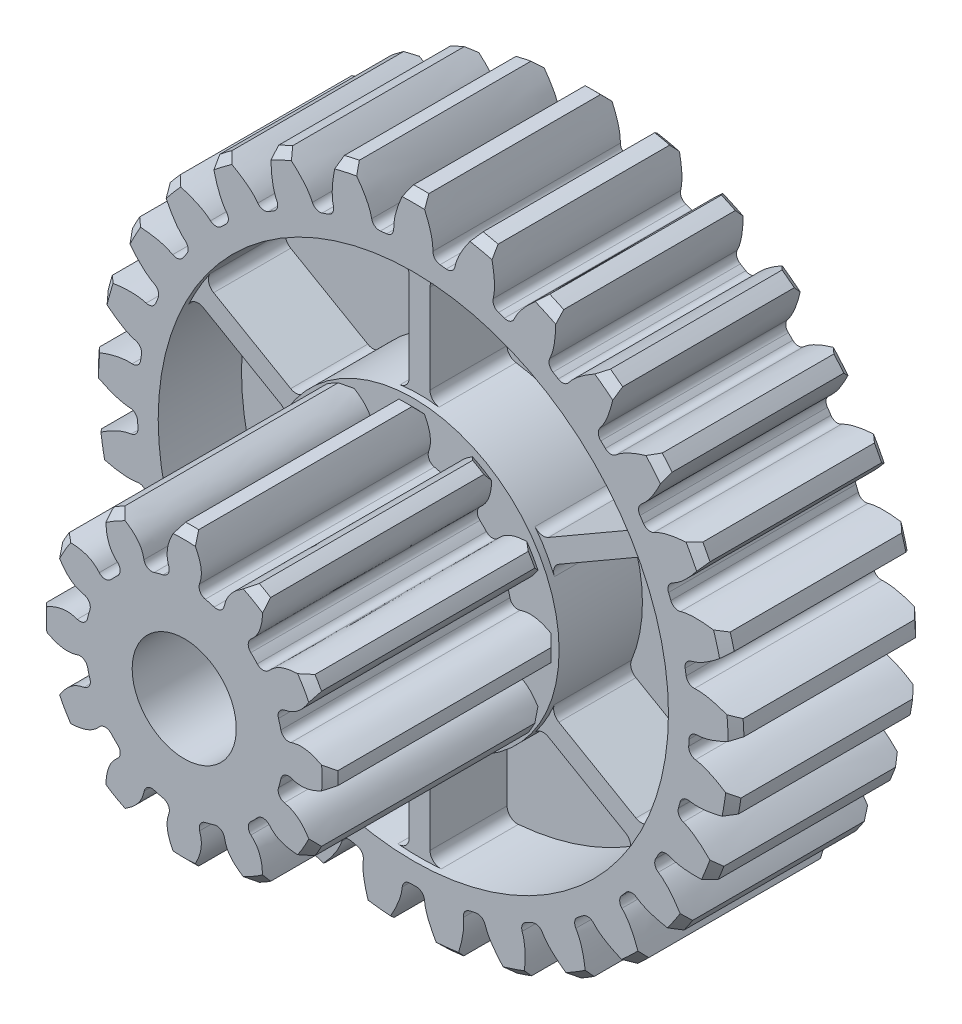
SolidWorks part; units mm, degrees
ref_plane "Plan de face" through (0, 0, 0) normal (0, 0, 1) x (1, 0, 0)
ref_plane "Plan de dessus" through (0, 0, 0) normal (0, 1, 0) x (1, 0, 0)
ref_plane "Plan de droite" through (0, 0, 0) normal (1, 0, 0) x (0, 0, -1)
other "Joindre1"
other "Roue dentée 29 dents module 1<1>@Roues dentées droites"
other "Roue dentée 12 dents module 1<1>@Roues dentées droites"
sketch "Esquisse2" plane through (0, 0, -14.5) normal (0, 0, -1) x (-1, 0, 0)
  circle A0 centre (4.4099, 0.9212) radius 2.5
  dimension "D1" = 5
extrude "Enlèv. mat.-Extru.1" cut sketch "Esquisse2" against normal through all
sketch "Esquisse3" plane through (0, 0, -14.5) normal (0, 0, -1) x (-1, 0, 0)
  line L0 (4.4099, 31.8895) -> (4.4099, -30.0472) construction
  line L1 (-26.6662, 18.863) -> (35.4861, -17.0206) construction
  line L2 (33.2505, 17.5723) -> (-24.4306, -15.7299) construction
  line L3 (3.9099, 12.6286) -> (3.9099, 4.7942)
  line L4 (14.2988, 7.2079) -> (7.514, 3.2907)
  line L5 (-5.9789, 6.3419) -> (0.8058, 2.4247)
  line L6 (4.9099, 12.6286) -> (4.9099, 4.7942)
  line L7 (1.3058, -1.4483) -> (-5.4789, -5.3655)
  line L8 (-5.4789, 7.2079) -> (1.3058, 3.2907)
  line L9 (14.7988, 6.3419) -> (8.014, 2.4247)
  line L10 (-26.4162, 19.296) -> (35.7361, -16.5876) construction
  line L11 (-26.9162, 18.43) -> (35.2361, -17.4536) construction
  line L12 (4.9099, 31.8895) -> (4.9099, -30.0472) construction
  line L13 (3.9099, 31.8895) -> (3.9099, -30.0472) construction
  line L14 (33.0005, 18.0053) -> (-24.6806, -15.2969) construction
  line L15 (0.8058, -0.5823) -> (-5.9789, -4.4995)
  line L16 (7.514, -1.4483) -> (14.2988, -5.3655)
  line L18 (3.9099, -2.9518) -> (3.9099, -10.7862)
  line L19 (8.014, -0.5823) -> (14.7988, -4.4995)
  line L20 (4.9099, -2.9518) -> (4.9099, -10.7862)
  arc A0 (5.4525, -11.2844) -> (14.459, -6.0845) centre (4.4099, 0.9212) ccw
  arc A1 (-5.6391, -6.0845) -> (3.3674, -11.2844) centre (4.4099, 0.9212) ccw
  circle A2 centre (4.4099, 0.9212) radius 3.5
  arc A3 (5.2849, -2.4677) -> (6.9073, -1.531) centre (4.4099, 0.9212) ccw
  circle A4 centre (4.4099, 0.9212) radius 13.25 construction
  arc A5 (-4.5927, 10.643) -> (-4.8102, 10.437) centre (4.4099, 0.9212) ccw construction
  arc A6 (-6.6817, 6.1211) -> (-6.6817, -4.2787) centre (4.4099, 0.9212) ccw
  arc A7 (3.3674, 13.1267) -> (-5.6391, 7.9268) centre (4.4099, 0.9212) ccw
  circle A8 centre (4.4099, 0.9212) radius 12.25 construction
  arc A9 (14.459, 7.9268) -> (5.4525, 13.1267) centre (4.4099, 0.9212) ccw
  arc A10 (15.5015, -4.2787) -> (15.5015, 6.1211) centre (4.4099, 0.9212) ccw
  arc A11 (7.7823, -0.0155) -> (7.7823, 1.8578) centre (4.4099, 0.9212) ccw
  arc A12 (1.9126, -1.531) -> (3.5349, -2.4677) centre (4.4099, 0.9212) ccw
  arc A13 (1.0376, 1.8578) -> (1.0376, -0.0155) centre (4.4099, 0.9212) ccw
  arc A14 (3.5349, 4.31) -> (1.9126, 3.3734) centre (4.4099, 0.9212) ccw
  arc A15 (6.9073, 3.3734) -> (5.2849, 4.31) centre (4.4099, 0.9212) ccw
  arc A16 (4.9099, -10.7862) -> (5.4525, -11.2844) centre (5.4099, -10.7862) ccw
  arc A17 (3.9099, -10.7862) -> (3.3674, -11.2844) centre (3.4099, -10.7862) cw
  arc A18 (-5.4789, -5.3655) -> (-5.6391, -6.0845) centre (-5.2289, -5.7985) ccw
  arc A19 (-5.9789, -4.4995) -> (-6.6817, -4.2787) centre (-6.2289, -4.0665) cw
  arc A20 (0.8058, 2.4247) -> (1.0376, 1.8578) centre (0.5558, 1.9917) cw
  arc A21 (0.8058, -0.5823) -> (1.0376, -0.0155) centre (0.5558, -0.1493) ccw
  arc A22 (1.3058, -1.4483) -> (1.9126, -1.531) centre (1.5558, -1.8813) cw
  arc A23 (3.9099, -2.9518) -> (3.5349, -2.4677) centre (3.4099, -2.9518) ccw
  arc A24 (4.9099, -2.9518) -> (5.2849, -2.4677) centre (5.4099, -2.9518) cw
  arc A25 (7.514, -1.4483) -> (6.9073, -1.531) centre (7.264, -1.8813) ccw
  arc A26 (14.459, -6.0845) -> (14.2988, -5.3655) centre (14.0488, -5.7985) ccw
  arc A27 (15.5015, -4.2787) -> (14.7988, -4.4995) centre (15.0488, -4.0665) cw
  arc A28 (8.014, -0.5823) -> (7.7823, -0.0155) centre (8.264, -0.1493) cw
  arc A29 (8.014, 2.4247) -> (7.7823, 1.8578) centre (8.264, 1.9917) ccw
  arc A30 (14.7988, 6.3419) -> (15.5015, 6.1211) centre (15.0488, 5.9088) cw
  arc A31 (14.2988, 7.2079) -> (14.459, 7.9268) centre (14.0488, 7.6409) ccw
  arc A32 (4.9099, 12.6286) -> (5.4525, 13.1267) centre (5.4099, 12.6286) cw
  arc A33 (7.514, 3.2907) -> (6.9073, 3.3734) centre (7.264, 3.7237) cw
  arc A34 (4.9099, 4.7942) -> (5.2849, 4.31) centre (5.4099, 4.7942) ccw
  arc A35 (1.3058, 3.2907) -> (1.9126, 3.3734) centre (1.5558, 3.7237) ccw
  arc A36 (3.9099, 4.7942) -> (3.5349, 4.31) centre (3.4099, 4.7942) cw
  arc A37 (3.9099, 12.6286) -> (3.3674, 13.1267) centre (3.4099, 12.6286) ccw
  arc A38 (-5.9789, 6.3419) -> (-6.6817, 6.1211) centre (-6.2289, 5.9088) ccw
  arc A39 (-5.4789, 7.2079) -> (-5.6391, 7.9268) centre (-5.2289, 7.6409) cw
  point P15 (33.5005, 17.1393)
  point P16 (-24.1806, -16.1629)
  point P30 (16.6599, 0.9212)
  point P55 (4.9099, -11.3186)
  point P60 (-5.94, -5.6317)
  point P65 (1.1599, 2.2202)
  point P68 (1.1599, -0.3779)
  point P71 (1.6599, -1.2439)
  point P84 (7.6599, -0.3779)
  point P87 (7.6599, 2.2202)
  point P92 (14.7599, 7.4741)
  point P97 (7.1599, 3.0862)
  point P100 (4.9099, 4.3853)
  point P103 (1.6599, 3.0862)
  point P106 (3.9099, 4.3853)
  point P109 (3.9099, 13.161)
  dimension "D7" = 0.5
  dimension "D1" = 60
  dimension "D2" = 60
  dimension "D3" = 0.5
  dimension "D4" = 0.5
  dimension "D5" = 1
  dimension "D6" = 1
extrude "Enlèv. mat.-Extru.2" cut sketch "Esquisse3" against normal blind 4
sketch "Esquisse4" plane through (0, 0, -5.5) normal (0, 0, 1) x (1, 0, 0)
  line L0 (-4.9099, 12.6286) -> (-4.9099, 4.7942) construction
  line L1 (-7.514, 3.2907) -> (-14.2988, 7.2079) construction
  line L2 (-3.9099, 4.7942) -> (-3.9099, 12.6286) construction
  line L3 (5.4789, 7.2079) -> (-1.3058, 3.2907) construction
  line L4 (-14.7988, 6.3419) -> (-8.014, 2.4247) construction
  line L5 (-8.014, -0.5823) -> (-14.7988, -4.4995) construction
  line L6 (-14.2988, -5.3655) -> (-7.514, -1.4483) construction
  line L7 (-4.9099, -2.9518) -> (-4.9099, -10.7862) construction
  line L8 (-3.9099, -10.7862) -> (-3.9099, -2.9518) construction
  line L9 (-1.3058, -1.4483) -> (5.4789, -5.3655) construction
  line L10 (5.9789, -4.4995) -> (-0.8058, -0.5823) construction
  line L11 (-0.8058, 2.4247) -> (5.9789, 6.3419) construction
  line L12 (-4.9099, 12.6286) -> (-4.9099, 8.3542)
  line L13 (-10.5971, 5.0707) -> (-14.2988, 7.2079)
  line L14 (-3.9099, 8.3542) -> (-3.9099, 12.6286)
  line L15 (5.4789, 7.2079) -> (1.7773, 5.0707)
  line L16 (-14.7988, 6.3419) -> (-11.0971, 4.2047)
  line L17 (-11.0971, -2.3623) -> (-14.7988, -4.4995)
  line L18 (-14.2988, -5.3655) -> (-10.5971, -3.2283)
  line L19 (-4.9099, -6.5118) -> (-4.9099, -10.7862)
  line L20 (-3.9099, -10.7862) -> (-3.9099, -6.5118)
  line L21 (1.7773, -3.2283) -> (5.4789, -5.3655)
  line L22 (5.9789, -4.4995) -> (2.2773, -2.3623)
  line L23 (2.2773, 4.2047) -> (5.9789, 6.3419)
  arc A0 (-14.459, 7.9268) -> (-14.2988, 7.2079) centre (-14.0488, 7.6409) ccw construction
  arc A1 (-5.4525, 13.1267) -> (-14.459, 7.9268) centre (-4.4099, 0.9212) ccw construction
  arc A2 (-4.9099, 12.6286) -> (-5.4525, 13.1267) centre (-5.4099, 12.6286) ccw construction
  arc A9 (-3.3674, 13.1267) -> (-3.9099, 12.6286) centre (-3.4099, 12.6286) ccw construction
  arc A10 (5.6391, 7.9268) -> (-3.3674, 13.1267) centre (-4.4099, 0.9212) ccw construction
  arc A11 (5.4789, 7.2079) -> (5.6391, 7.9268) centre (5.2289, 7.6409) ccw construction
  arc A12 (-15.5015, -4.2787) -> (-14.7988, -4.4995) centre (-15.0488, -4.0665) ccw construction
  arc A13 (-15.5015, 6.1211) -> (-15.5015, -4.2787) centre (-4.4099, 0.9212) ccw construction
  arc A14 (-14.7988, 6.3419) -> (-15.5015, 6.1211) centre (-15.0488, 5.9088) ccw construction
  arc A18 (-5.4525, -11.2844) -> (-4.9099, -10.7862) centre (-5.4099, -10.7862) ccw construction
  arc A19 (-14.459, -6.0845) -> (-5.4525, -11.2844) centre (-4.4099, 0.9212) ccw construction
  arc A20 (-14.2988, -5.3655) -> (-14.459, -6.0845) centre (-14.0488, -5.7985) ccw construction
  arc A24 (-3.9099, -10.7862) -> (-3.3674, -11.2844) centre (-3.4099, -10.7862) ccw construction
  arc A28 (5.6391, -6.0845) -> (5.4789, -5.3655) centre (5.2289, -5.7985) ccw construction
  arc A29 (-3.3674, -11.2844) -> (5.6391, -6.0845) centre (-4.4099, 0.9212) ccw construction
  arc A30 (5.9789, -4.4995) -> (6.6817, -4.2787) centre (6.2289, -4.0665) ccw construction
  arc A34 (6.6817, 6.1211) -> (5.9789, 6.3419) centre (6.2289, 5.9088) ccw construction
  arc A35 (6.6817, -4.2787) -> (6.6817, 6.1211) centre (-4.4099, 0.9212) ccw construction
  arc A36 (-14.459, 7.9268) -> (-14.2988, 7.2079) centre (-14.0488, 7.6409) ccw
  arc A37 (-5.4525, 13.1267) -> (-14.459, 7.9268) centre (-4.4099, 0.9212) ccw
  arc A38 (-4.9099, 12.6286) -> (-5.4525, 13.1267) centre (-5.4099, 12.6286) ccw
  arc A39 (-10.8846, 3.5816) -> (-10.8846, -1.7393) centre (-4.4099, 0.9212) ccw
  arc A40 (-9.9513, -3.3559) -> (-5.3433, -6.0163) centre (-4.4099, 0.9212) ccw
  arc A41 (-3.4766, -6.0163) -> (1.1315, -3.3559) centre (-4.4099, 0.9212) ccw
  arc A42 (2.0648, -1.7393) -> (2.0648, 3.5816) centre (-4.4099, 0.9212) ccw
  arc A43 (1.1315, 5.1982) -> (-3.4766, 7.8587) centre (-4.4099, 0.9212) ccw
  arc A44 (-4.9099, 8.3542) -> (-5.3433, 7.8587) centre (-5.4099, 8.3542) cw
  arc A45 (-3.3674, 13.1267) -> (-3.9099, 12.6286) centre (-3.4099, 12.6286) ccw
  arc A46 (5.6391, 7.9268) -> (-3.3674, 13.1267) centre (-4.4099, 0.9212) ccw
  arc A47 (5.4789, 7.2079) -> (5.6391, 7.9268) centre (5.2289, 7.6409) ccw
  arc A48 (-15.5015, -4.2787) -> (-14.7988, -4.4995) centre (-15.0488, -4.0665) ccw
  arc A49 (-15.5015, 6.1211) -> (-15.5015, -4.2787) centre (-4.4099, 0.9212) ccw
  arc A50 (-14.7988, 6.3419) -> (-15.5015, 6.1211) centre (-15.0488, 5.9088) ccw
  arc A51 (-3.9099, 8.3542) -> (-3.4766, 7.8587) centre (-3.4099, 8.3542) ccw
  arc A52 (1.7773, 5.0707) -> (1.1315, 5.1982) centre (1.5273, 5.5037) cw
  arc A53 (2.2773, 4.2047) -> (2.0648, 3.5816) centre (2.5273, 3.7717) ccw
  arc A54 (-5.4525, -11.2844) -> (-4.9099, -10.7862) centre (-5.4099, -10.7862) ccw
  arc A55 (-14.459, -6.0845) -> (-5.4525, -11.2844) centre (-4.4099, 0.9212) ccw
  arc A56 (-14.2988, -5.3655) -> (-14.459, -6.0845) centre (-14.0488, -5.7985) ccw
  arc A57 (2.2773, -2.3623) -> (2.0648, -1.7393) centre (2.5273, -1.9293) cw
  arc A58 (1.7773, -3.2283) -> (1.1315, -3.3559) centre (1.5273, -3.6614) ccw
  arc A59 (-3.9099, -6.5118) -> (-3.4766, -6.0163) centre (-3.4099, -6.5118) cw
  arc A60 (-3.9099, -10.7862) -> (-3.3674, -11.2844) centre (-3.4099, -10.7862) ccw
  arc A61 (-4.9099, -6.5118) -> (-5.3433, -6.0163) centre (-5.4099, -6.5118) ccw
  arc A62 (-10.5971, -3.2283) -> (-9.9513, -3.3559) centre (-10.3471, -3.6614) cw
  arc A63 (-11.0971, -2.3623) -> (-10.8846, -1.7393) centre (-11.3471, -1.9293) ccw
  arc A64 (5.6391, -6.0845) -> (5.4789, -5.3655) centre (5.2289, -5.7985) ccw
  arc A65 (-3.3674, -11.2844) -> (5.6391, -6.0845) centre (-4.4099, 0.9212) ccw
  arc A66 (5.9789, -4.4995) -> (6.6817, -4.2787) centre (6.2289, -4.0665) ccw
  arc A67 (-11.0971, 4.2047) -> (-10.8846, 3.5816) centre (-11.3471, 3.7717) cw
  arc A68 (-10.5971, 5.0707) -> (-9.9513, 5.1982) centre (-10.3471, 5.5037) ccw
  arc A70 (6.6817, 6.1211) -> (5.9789, 6.3419) centre (6.2289, 5.9088) ccw
  arc A71 (6.6817, -4.2787) -> (6.6817, 6.1211) centre (-4.4099, 0.9212) ccw
  arc A72 (-5.3433, 7.8587) -> (-9.9513, 5.1982) centre (-4.4099, 0.9212) ccw
  point P31 (1.3868, 4.8453)
  point P43 (1.8868, 3.9792)
  point P52 (1.8868, -2.1369)
  point P64 (1.3868, -3.0029)
  point P73 (-3.9099, -6.0609)
  point P80 (-4.9099, -6.0609)
  point P84 (-10.2066, -3.0029)
  point P89 (-10.7066, -2.1369)
  point P92 (-10.7066, 3.9792)
  dimension "D1" = 0.5
extrude "Enlèv. mat.-Extru.3" cut sketch "Esquisse4" against normal blind 4
sketch "Esquisse5" plane through (0, 0, -14.5) normal (0, 0, -1) x (-1, 0, 0)
  arc A0 (5.4525, -11.2844) -> (14.459, -6.0845) centre (4.4099, 0.9212) ccw construction
  circle A1 centre (4.4099, 0.9212) radius 12.25
extrude "Enlèv. mat.-Extru.4" cut sketch "Esquisse5" against normal blind 0.3
sketch "Esquisse6" plane through (0, 0, -5.5) normal (0, 0, 1) x (1, 0, 0)
  circle A0 centre (-4.4099, 0.9212) radius 12.25 construction
  circle A1 centre (-4.4099, 0.9212) radius 12.25
  arc A2 (-9.9513, -3.3559) -> (-5.3433, -6.0163) centre (-4.4099, 0.9212) ccw construction
  circle A3 centre (-4.4099, 0.9212) radius 7
extrude "Enlèv. mat.-Extru.6" cut sketch "Esquisse6" against normal blind 0.3
